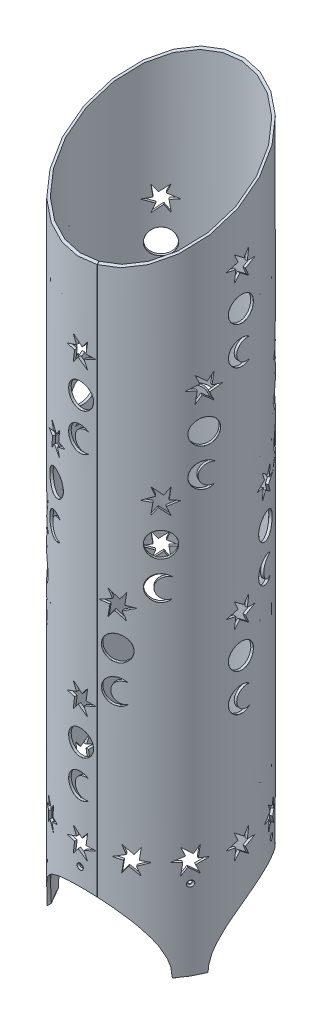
SolidWorks part; units mm, degrees
ref_plane "Vorne" through (0, 0, 0) normal (0, 0, 1) x (1, 0, 0)
ref_plane "Oben" through (0, 0, 0) normal (0, 1, 0) x (1, 0, 0)
ref_plane "Rechts" through (0, 0, 0) normal (1, 0, 0) x (0, 0, -1)
sketch "Skizze1" plane through (0, 0, 0) normal (0, 1, 0) x (1, 0, 0)
  circle A0 centre (0, 0) radius 161.5
  circle A1 centre (0, 0) radius 156.5
  dimension "D1" = 5
  dimension "D2" = 323
extrude "Aufsatz-Linear austragen1" add sketch "Skizze1" along normal blind 1400
ref_plane "Ebene1" through (0, 300, 0) normal (0, 1, 0) x (-1, 0, 0)
sketch "Skizze3" plane through (0, 300, 0) normal (0, 1, 0) x (-1, 0, 0)
  circle A0 centre (0, 0) radius 161.5 construction
  circle A1 centre (0, 0) radius 161.5
curve "Spirale/Helix1"
sketch "Skizze4" plane through (0, 0, 0) normal (0, 0, 1) x (1, 0, 0)
  line L0 (50, 300) -> (-50, 300) construction
  line L1 (0, 300) -> (0, 0) construction
  line L2 (0, 1400) -> (0, 0) construction
  line L3 (-14.4338, 425) -> (14.4338, 425) construction
  line L4 (14.4338, 425) -> (28.8675, 450) construction
  line L5 (28.8675, 450) -> (14.4338, 475) construction
  line L6 (14.4338, 475) -> (-14.4338, 475) construction
  line L7 (-14.4338, 475) -> (-28.8675, 450) construction
  line L8 (-28.8675, 450) -> (-14.4338, 425) construction
  line L9 (3.9493, 460.8506) -> (-7.4223, 458.8455) construction
  line L10 (-7.4223, 458.8455) -> (-11.3716, 447.9949) construction
  line L11 (-11.3716, 447.9949) -> (-3.9493, 439.1494) construction
  line L12 (-3.9493, 439.1494) -> (7.4223, 441.1545) construction
  line L13 (7.4223, 441.1545) -> (11.3716, 452.0051) construction
  line L14 (11.3716, 452.0051) -> (3.9493, 460.8506) construction
  line L15 (-14.4338, 475) -> (-7.4223, 458.8455)
  line L16 (-7.4223, 458.8455) -> (-28.8675, 450)
  line L17 (-28.8675, 450) -> (-11.3716, 447.9949)
  line L18 (-11.3716, 447.9949) -> (-14.4338, 425)
  line L19 (-14.4338, 425) -> (-3.9493, 439.1494)
  line L20 (-3.9493, 439.1494) -> (14.4338, 425)
  line L21 (14.4338, 425) -> (7.4223, 441.1545)
  line L22 (7.4223, 441.1545) -> (28.8675, 450)
  line L23 (28.8675, 450) -> (11.3716, 452.0051)
  line L24 (11.3716, 452.0051) -> (14.4338, 475)
  line L25 (14.4338, 475) -> (3.9493, 460.8506)
  line L27 (3.9493, 460.8506) -> (-14.4338, 475)
  arc A0 (16.25, 318.9984) -> (16.25, 281.0016) centre (0, 300) ccw
  arc A1 (16.25, 318.9984) -> (16.25, 281.0016) centre (10, 300) ccw
  circle A2 centre (0, 375) radius 25
  circle A3 centre (0, 450) radius 25 construction
  circle A4 centre (0, 450) radius 10 construction
  dimension "D1" = 50
  dimension "D2" = 40
  dimension "D3" = 10
  dimension "D4" = 75
  dimension "D5" = 75
  dimension "D6" = 20
  dimension "D7" = 80
extrude "Schnitt-Linear austragen1" cut sketch "Skizze4" along normal through all
pattern_curve "Kurvenmuster1" of "Schnitt-Linear austragen1" parameters "D1"=21, "D3"=1, "D2"=1, "D4"=1
sketch "Skizze5" plane through (0, 0, 0) normal (0, 0, 1) x (1, 0, 0)
  line L0 (-161.5, 0) -> (161.5, 0) construction
  line L1 (-125, 0) -> (125, 0)
  arc A0 (-125, 0) -> (125, 0) centre (0, 0) cw
  dimension "D1" = 125
extrude "Schnitt-Linear austragen2" cut sketch "Skizze5" along normal through all
sketch "Skizze6" plane through (0, 0, 0) normal (0, 0, 1) x (1, 0, 0)
  line L0 (0, 0) -> (0, 144.8412) construction
pattern_circular "Kreismuster1" count 3 over 360 about axis through (0, 0, 0) along (0, 1, 0) of "Schnitt-Linear austragen2"
sketch "Skizze9" plane through (0, 0, 0) normal (0, 0, 1) x (1, 0, 0)
  line L0 (0, 1400) -> (0, 0) construction
  line L1 (-14.4338, 225) -> (-28.8675, 200) construction
  line L2 (-28.8675, 200) -> (-14.4338, 175) construction
  line L3 (-14.4338, 175) -> (14.4338, 175) construction
  line L4 (14.4338, 175) -> (28.8675, 200) construction
  line L5 (28.8675, 200) -> (14.4338, 225) construction
  line L6 (14.4338, 225) -> (-14.4338, 225) construction
  line L7 (-136.7736, 0) -> (20.9162, 0) construction
  line L8 (-14.4338, 225) -> (-7.4223, 208.8455)
  line L9 (-7.4223, 208.8455) -> (-11.3716, 197.9949) construction
  line L10 (-11.3716, 197.9949) -> (-3.9493, 189.1494) construction
  line L11 (-3.9493, 189.1494) -> (7.4223, 191.1545) construction
  line L12 (7.4223, 191.1545) -> (11.3716, 202.0051) construction
  line L13 (11.3716, 202.0051) -> (3.9493, 210.8506) construction
  line L14 (3.9493, 210.8506) -> (-7.4223, 208.8455) construction
  line L15 (-7.4223, 208.8455) -> (-28.8675, 200)
  line L16 (-28.8675, 200) -> (-11.3716, 197.9949)
  line L17 (-11.3716, 197.9949) -> (-14.4338, 175)
  line L18 (-14.4338, 175) -> (-3.9493, 189.1494)
  line L19 (-3.9493, 189.1494) -> (14.4338, 175)
  line L20 (14.4338, 175) -> (7.4223, 191.1545)
  line L21 (7.4223, 191.1545) -> (28.8675, 200)
  line L22 (28.8675, 200) -> (11.3716, 202.0051)
  line L23 (11.3716, 202.0051) -> (14.4338, 225)
  line L24 (14.4338, 225) -> (3.9493, 210.8506)
  line L25 (3.9493, 210.8506) -> (-14.4338, 225)
  circle A0 centre (0, 200) radius 25 construction
  circle A1 centre (0, 200) radius 10 construction
  dimension "D1" = 50
  dimension "D2" = 200
  dimension "D3" = 20
  dimension "D4" = 80
extrude "Schnitt-Linear austragen5" cut sketch "Skizze9" along normal through all
pattern_circular "Kreismuster2" count 12 over 360 about axis through (0, 0, 0) along (0, 1, 0) of "Schnitt-Linear austragen5"
sketch "Skizze10" plane through (0, 0, 0) normal (1, 0, 0) x (0, 0, -1)
  line L0 (161.5, 1400) -> (-161.5, 1400)
  line L1 (-161.5, 1400) -> (-161.5, 1213.5159)
  line L2 (-161.5, 1213.5159) -> (161.5, 1400)
  line L3 (156.5, 1400) -> (-156.5, 1400) construction
  line L4 (161.5, 763.8823) -> (161.5, 1400) construction
  line L5 (-161.5, 1400) -> (-161.5, 1063.8742) construction
  dimension "D1" = 30
extrude "Schnitt-Linear austragen6" cut sketch "Skizze10" against normal through all and the other way through all
sketch "Skizze11" plane through (0, 0, 0) normal (0, 0, 1) x (1, 0, 0)
  line L0 (0, 1400) -> (0, 0) construction
  line L1 (136.7736, 0) -> (-20.9162, 0) construction
  circle A0 centre (0, 160) radius 3.25
  dimension "D1" = 6.5
  dimension "D2" = 160
extrude "Schnitt-Linear austragen7" cut sketch "Skizze11" along normal through all
pattern_circular "Kreismuster3" count 6 over 360 about axis through (0, 1400, 0) along (0, -1, 0) of "Schnitt-Linear austragen7"
chamfer "Fase1" distance 3 angle 45 6 edges at (-0.7468, 163.163, 161.4983) (138.2548, 159.2532, 83.4738) (-141.4178, 160.7468, -77.9952) (138.2548, 160.7468, -83.4738) (-0.7468, 156.837, -161.4983) (-138.2548, 160.7468, 83.4738)
sketch "Skizze12" plane through (0, 0, 0) normal (0, 1, 0) x (1, 0, 0)
  line L0 (29.6467, -152.519) -> (0, 0) construction
  line L1 (29.6467, -152.519) -> (30.1375, -152.4236)
  line L2 (29.6467, -152.519) -> (31.2994, -161.1508)
  line L3 (31.2994, -161.1508) -> (31.7905, -161.0567)
  line L4 (30.1375, -152.4236) -> (31.7905, -161.0567)
  line L5 (0, 0) -> (-35.8457, 0) construction
  dimension "D1" = 0.5
  dimension "D3" = 101
extrude "Schnitt-Linear austragen9" cut sketch "Skizze12" along normal through all
